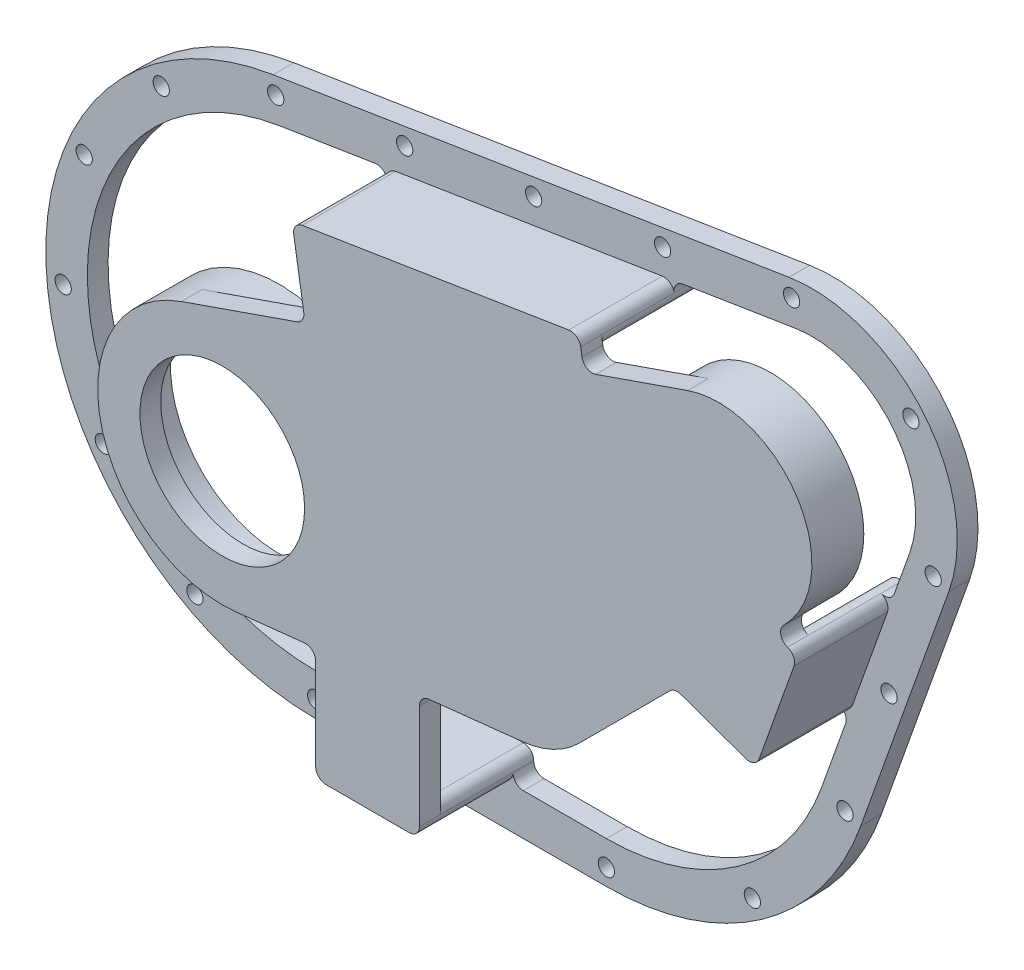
SolidWorks part; units mm, degrees
ref_plane "Front Plane" through (0, 0, 0) normal (0, 0, 1) x (1, 0, 0)
ref_plane "Top Plane" through (0, 0, 0) normal (0, 1, 0) x (1, 0, 0)
ref_plane "Right Plane" through (0, 0, 0) normal (1, 0, 0) x (0, 0, -1)
sketch "Sketch1" plane through (0, 0, 0) normal (0, 0, 1) x (1, 0, 0)
  line L0 (0, 0) -> (88.9, 0) construction
  line L1 (88.9, 0) -> (109.1056, 20.2056) construction
  line L2 (-12.5146, 35.986) -> (25.3404, 49.1506)
  line L3 (4.0821, -37.8807) -> (28.575, -35.2413)
  line L4 (109.1056, -20.2056) -> (138.3157, 9.0045)
  line L5 (-11.0336, 68.973) -> (146.7465, 94.2132) construction
  line L6 (0, -69.85) -> (88.9, -69.85) construction
  line L7 (181.6678, 52.1992) -> (154.6933, -23.4578) construction
  line L8 (28.575, -69.85) -> (28.575, -35.2413)
  line L9 (60.325, -69.85) -> (60.325, -31.8198)
  line L10 (28.575, -69.85) -> (60.325, -69.85)
  line L11 (60.325, -31.8198) -> (91.9616, -28.4105)
  line L12 (163.1149, 0.1627) -> (138.3157, 9.0045)
  line L13 (175.91, 36.0499) -> (168.1336, 38.8225)
  line L14 (129.3112, 40.4112) -> (151.7618, 62.8618) construction
  line L15 (163.1149, 0.1627) -> (175.91, 36.0499)
  line L16 (168.1336, 38.8225) -> (171.9674, 42.6562)
  line L17 (21.341, 74.152) -> (25.3404, 49.1506)
  line L18 (109.1248, 88.1948) -> (110.6261, 78.8099)
  line L19 (21.341, 74.152) -> (109.1248, 88.1948)
  line L20 (110.6261, 78.8099) -> (142.3758, 89.8513)
  circle A0 centre (0, 0) radius 25.1841
  circle A1 centre (0, 0) radius 69.85 construction
  circle A2 centre (88.9, 0) radius 69.85 construction
  circle A3 centre (88.9, 0) radius 23.8125
  circle A4 centre (151.7618, 62.8618) radius 23.8125
  circle A5 centre (88.9, 0) radius 28.575
  circle A6 centre (151.7618, 62.8618) radius 28.575
  circle A7 centre (0, 0) radius 33.3375
  circle A8 centre (0, 0) radius 38.1
  circle A9 centre (151.7618, 62.8618) radius 31.75 construction
  dimension "D1" = 50.3682
  dimension "D2" = 139.7
  dimension "D3" = 139.7
  dimension "D4" = 47.625
  dimension "D5" = 47.625
  dimension "D6" = 57.15
  dimension "D7" = 57.15
  dimension "D8" = 66.675
  dimension "D9" = 76.2
  dimension "D13" = 63.5
  dimension "D10" = 88.9
  dimension "D11" = 88.9
  dimension "D12" = 225
  dimension "D14" = 31.75
  dimension "D15" = 28.575
  dimension "D16" = 38.1
  dimension "D17" = 17.145
  dimension "D18" = 88.9
  dimension "D19" = 38.1
extrude "Boss-Extrude1" add sketch "Sketch1" along normal blind 6.35
sketch "Sketch2" plane through (0, 0, 6.35) normal (0, 0, 1) x (1, 0, 0)
  circle A0 centre (151.7618, 62.8618) radius 23.8125
  circle A1 centre (151.7618, 62.8618) radius 28.575
  circle A2 centre (88.9, 0) radius 23.8125
  circle A3 centre (88.9, 0) radius 28.575
  dimension "D1" = 57.15
  dimension "D2" = 47.625
  dimension "D3" = 57.15
  dimension "D4" = 47.625
extrude "Boss-Extrude2" add sketch "Sketch2" against normal blind 15.875
sketch "Sketch3" plane through (0, 0, 6.35) normal (0, 0, 1) x (1, 0, 0)
  circle A0 centre (0, 0) radius 33.3375
  circle A1 centre (0, 0) radius 38.1
  dimension "D1" = 66.675
  dimension "D2" = 76.2
extrude "Boss-Extrude3" add sketch "Sketch3" against normal blind 17.4625
sketch "Sketch4" plane through (0, 0, 0) normal (0, 0, -1) x (-1, 0, 0)
  line L0 (-109.1248, 88.1948) -> (-21.341, 74.152)
  line L1 (-21.341, 74.152) -> (-22.344, 67.8817)
  line L2 (-21.341, 74.152) -> (-25.3404, 49.1506) construction
  line L3 (-22.344, 67.8817) -> (-110.1279, 81.9246)
  line L4 (-109.1248, 88.1948) -> (-110.6261, 78.8099) construction
  line L5 (-110.1279, 81.9246) -> (-109.1248, 88.1948)
  line L6 (-175.91, 36.0499) -> (-163.1149, 0.1627)
  line L7 (-163.1149, 0.1627) -> (-157.1336, 2.2952)
  line L8 (-163.1149, 0.1627) -> (-138.3157, 9.0045) construction
  line L9 (-157.1336, 2.2952) -> (-169.9288, 38.1824)
  line L10 (-175.91, 36.0499) -> (-168.1336, 38.8225) construction
  line L11 (-169.9288, 38.1824) -> (-175.91, 36.0499)
  line L12 (-60.325, -69.85) -> (-28.575, -69.85)
  line L13 (-28.575, -69.85) -> (-28.575, -63.5)
  line L14 (-28.575, -69.85) -> (-28.575, -35.2413) construction
  line L15 (-28.575, -63.5) -> (-60.325, -63.5)
  line L16 (-60.325, -69.85) -> (-60.325, -31.8198) construction
  line L17 (-60.325, -63.5) -> (-60.325, -69.85)
  dimension "D1" = 6.35
  dimension "D2" = 6.35
  dimension "D3" = 6.35
extrude "Boss-Extrude4" add sketch "Sketch4" along normal blind 28.575
sketch "Sketch5" plane through (0, 0, -28.575) normal (0, 0, -1) x (-1, 0, 0)
  line L0 (-146.7465, 94.2132) -> (11.0336, 68.973)
  line L1 (-181.6678, 52.1992) -> (-154.6933, -23.4578)
  line L2 (-88.9, -69.85) -> (0, -69.85)
  line L3 (-144.7404, 106.7537) -> (13.0398, 81.5136)
  line L4 (-88.9, -82.55) -> (0, -82.55)
  line L5 (-193.6302, 47.9341) -> (-166.6557, -27.7228)
  line L6 (-145.5428, 101.7375) -> (12.2373, 76.4974) construction
  line L7 (-88.9, -77.47) -> (0, -77.47) construction
  line L8 (-188.8453, 49.6401) -> (-161.8707, -26.0168) construction
  arc A0 (0, -69.85) -> (11.0336, 68.973) centre (0, 0) ccw
  arc A1 (0, -82.55) -> (13.0398, 81.5136) centre (0, 0) ccw
  arc A2 (-146.7465, 94.2132) -> (-181.6678, 52.1992) centre (-151.7618, 62.8618) ccw
  arc A3 (-154.6933, -23.4578) -> (-88.9, -69.85) centre (-88.9, 0) ccw
  arc A4 (0, -77.47) -> (12.2373, 76.4974) centre (0, 0) ccw construction
  arc A5 (-161.8707, -26.0168) -> (-88.9, -77.47) centre (-88.9, 0) ccw construction
  arc A6 (-166.6557, -27.7228) -> (-88.9, -82.55) centre (-88.9, 0) ccw
  arc A7 (-144.7404, 106.7537) -> (-193.6302, 47.9341) centre (-151.7618, 62.8618) ccw
  arc A8 (-145.5428, 101.7375) -> (-188.8453, 49.6401) centre (-151.7618, 62.8618) ccw construction
  dimension "D1" = 12.7
  dimension "D2" = 7.62
extrude "Boss-Extrude5" add sketch "Sketch5" against normal blind 6.35
fillet "Fillet1" radius 3.175 12 edges at (21.341, 74.152, -25.4) (22.344, 67.8817, -14.2875) (109.1248, 88.1948, -25.4) (110.1279, 81.9246, -14.2875) (60.325, -63.5, -14.2875) (60.325, -69.85, -25.4) (28.575, -69.85, -25.4) (28.575, -63.5, -14.2875) (169.9288, 38.1824, -14.2875) (157.1336, 2.2952, -14.2875) (163.1149, 0.1627, -25.4) (175.91, 36.0499, -25.4)
fillet "Fillet2" radius 3.175 12 edges at (168.1336, 38.8225, 3.175) (138.3157, 9.0045, 3.175) (60.325, -31.8198, 3.175) (28.575, -35.2413, 3.175) (25.3404, 49.1506, 3.175) (110.6261, 78.8099, 3.175) (163.1149, 0.1627, -7.9375) (60.325, -69.85, -7.9375) (28.575, -69.85, -7.9375) (21.341, 74.152, -7.9375) (109.1248, 88.1948, -7.9375) (175.91, 36.0499, -7.9375)
sketch "Sketch6" plane through (0, 0, -28.575) normal (0, 0, -1) x (-1, 0, 0)
  circle A0 centre (12.2373, 76.4974) radius 2.4892
  dimension "D1" = 4.9784
extrude "Cut-Extrude1" cut sketch "Sketch6" against normal through all
pattern_curve "CrvPattern4" of "Cut-Extrude1" parameters "D1"=7, "D3"=50.8, "D2"=1, "D4"=2.54
pattern_curve "CrvPattern5" of "Cut-Extrude1" parameters "D1"=5, "D3"=50.8, "D2"=1, "D4"=2.54
sketch "Sketch7" plane through (0, 0, -28.575) normal (0, 0, -1) x (-1, 0, 0)
  circle A0 centre (-188.8453, 49.6401) radius 2.4892
  dimension "D1" = 4.9784
extrude "Cut-Extrude2" cut sketch "Sketch7" against normal through all
pattern_curve "CrvPattern6" of "Cut-Extrude2" parameters "D1"=3, "D3"=50.8, "D2"=1, "D4"=2.54
pattern_curve "CrvPattern7" of "Cut-Extrude2" parameters "D1"=3, "D3"=50.8, "D2"=1, "D4"=2.54
sketch "Sketch8" plane through (0, 0, -28.575) normal (0, 0, -1) x (-1, 0, 0)
  circle A0 centre (-88.9, -77.47) radius 2.4892
  dimension "D1" = 4.9784
extrude "Cut-Extrude3" cut sketch "Sketch8" against normal through all
pattern_curve "CrvPattern8" of "Cut-Extrude3" parameters "D1"=3, "D3"=50.8, "D2"=1, "D4"=2.54
pattern_curve "CrvPattern9" of "Cut-Extrude3" parameters "D1"=3, "D3"=50.8, "D2"=1, "D4"=2.54
